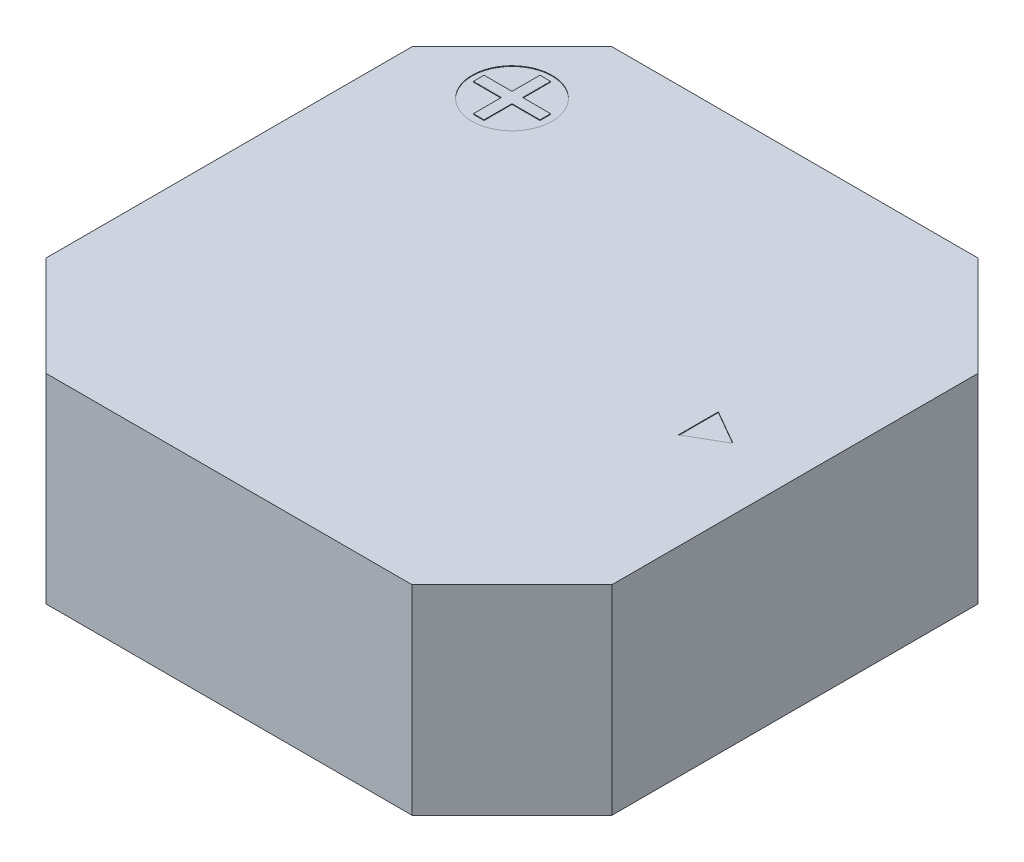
SolidWorks part; units mm, degrees
ref_plane "Plan de face" through (0, 0, 0) normal (0, 0, 1) x (1, 0, 0)
ref_plane "Plan de dessus" through (0, 0, 0) normal (0, 1, 0) x (1, 0, 0)
ref_plane "Plan de droite" through (0, 0, 0) normal (1, 0, 0) x (0, 0, -1)
sketch "Esquisse1" plane through (0, 0, 0) normal (0, 1, 0) x (1, 0, 0)
  line L0 (-4.25, 2.75) -> (-2.75, 4.25)
  line L1 (-2.75, -4.25) -> (2.75, -4.25)
  line L2 (-4.25, -2.75) -> (-4.25, 2.75)
  line L3 (-2.75, 4.25) -> (2.75, 4.25)
  line L4 (4.25, -2.75) -> (4.25, 2.75)
  line L5 (-4.25, -4.25) -> (4.25, 4.25) construction
  line L6 (-4.25, 4.25) -> (4.25, -4.25) construction
  line L7 (2.75, -4.25) -> (4.25, -2.75)
  line L8 (2.75, 4.25) -> (4.25, 2.75)
  line L9 (-4.25, -2.75) -> (-2.75, -4.25)
  point P0 (0, 0)
  dimension "D1" = 8.5
  dimension "D2" = 8.5
extrude "Boss.-Extru.1" add sketch "Esquisse1" along normal blind 3
sketch "Esquisse2" plane through (0, 3, 0) normal (0, 1, 0) x (1, 0, 0)
  line L0 (-4.9764, 0) -> (4.929, 0) construction
  line L1 (0, -4.6917) -> (0, 4.5375) construction
  line L2 (2.8, 0.3) -> (2.8, -0.3)
  line L3 (2.8, -0.3) -> (3.3196, 0)
  line L4 (3.3196, 0) -> (2.8, 0.3)
  line L5 (0, 0) -> (-3.974, 3.974) construction
  circle A0 centre (-2.8284, 2.8284) radius 0.6
  dimension "D2" = 1.2
  dimension "D1" = 45
  dimension "D3" = 4
  dimension "D4" = 2.8
  dimension "D5" = 0.6
  dimension "D6" = 0.6
extrude "Enlèv. mat.-Extru.1" cut sketch "Esquisse2" against normal blind 0.01
sketch "Esquisse3" plane through (0, 3, 0) normal (0, 1, 0) x (1, 0, 0)
  line L0 (-3.7664, 2.8284) -> (-1.7142, 2.8284) construction
  line L1 (-2.8284, 1.6904) -> (-2.8284, 3.719) construction
  line L2 (-2.9084, 3.3284) -> (-2.9084, 2.9084)
  line L3 (-2.9084, 2.9084) -> (-3.3284, 2.9084)
  line L4 (-3.3284, 2.9084) -> (-3.3284, 2.7484)
  line L5 (-3.3284, 2.7484) -> (-2.9084, 2.7484)
  line L6 (-2.9084, 2.7484) -> (-2.9084, 2.3284)
  line L7 (-2.9084, 2.3284) -> (-2.7484, 2.3284)
  line L8 (-2.9084, 3.3284) -> (-2.7484, 3.3284)
  line L9 (-2.7484, 2.7484) -> (-2.7484, 2.3284)
  line L11 (-2.3284, 2.7484) -> (-2.7484, 2.7484)
  line L12 (-2.3284, 2.9084) -> (-2.3284, 2.7484)
  line L13 (-2.7484, 2.9084) -> (-2.3284, 2.9084)
  line L14 (-2.7484, 3.3284) -> (-2.7484, 2.9084)
  circle A0 centre (-2.8284, 2.8284) radius 0.6 construction
  point P4 (-2.8284, 2.8284)
  point P16 (-2.8284, 2.3284)
  point P24 (-2.8284, 3.3284)
  dimension "D1" = 0.16
  dimension "D2" = 0.08
  dimension "D3" = 1
  dimension "D4" = 0.5
extrude "Boss.-Extru.2" add sketch "Esquisse3" along normal blind 0.01 separate body
